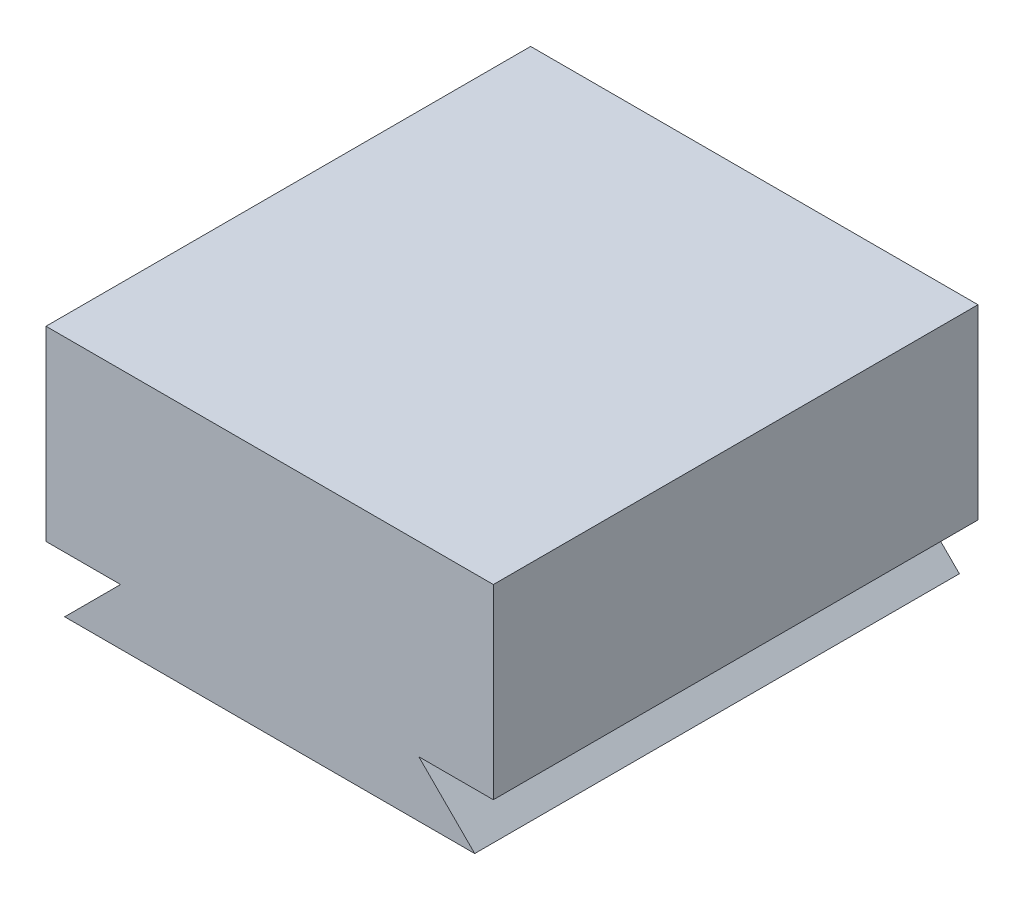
SolidWorks part; units mm, degrees
ref_plane "Face" through (0, 0, 0) normal (0, 0, 1) x (1, 0, 0)
ref_plane "Dessus" through (0, 0, 0) normal (0, 1, 0) x (1, 0, 0)
ref_plane "Droite" through (0, 0, 0) normal (1, 0, 0) x (0, 0, -1)
sketch "Esquisse1" plane through (0, 0, 0) normal (0, 0, 1) x (1, 0, 0)
  line L1 (0, 0) -> (24, 0)
  line L2 (0, 0) -> (0, 13)
  line L3 (0, 13) -> (24, 13)
  line L4 (24, 0) -> (24, 13)
  dimension "D1" = 24
  dimension "D2" = 13
extrude "Base-Extrusion" add sketch "Esquisse1" along normal blind 26
sketch "Esquisse2" plane through (0, 0, 26) normal (0, 0, 1) x (1, 0, 0)
  line L0 (12, 0) -> (12, 15.861) construction
  line L1 (0, 0) -> (24, 0) construction
  line L2 (0, 0) -> (1, 0)
  line L3 (1, 0) -> (4, 3)
  line L4 (4, 3) -> (0, 3)
  line L5 (0, 13) -> (0, 0) construction
  line L6 (0, 3) -> (0, 0)
  line L7 (24, 3) -> (24, 0)
  line L8 (20, 3) -> (24, 3)
  line L9 (23, 0) -> (20, 3)
  line L10 (24, 0) -> (23, 0)
  dimension "D1" = 16
  dimension "D2" = 3
  dimension "D3" = 45
extrude "Enlèv. mat.-Extru.1" cut sketch "Esquisse2" against normal through all
sketch "Esquisse3" plane through (0, 13, 0) normal (0, 1, 0) x (-1, 0, 0)
  line L0 (0, 26) -> (-24, 0) construction
  point P4 (-12, 13)
